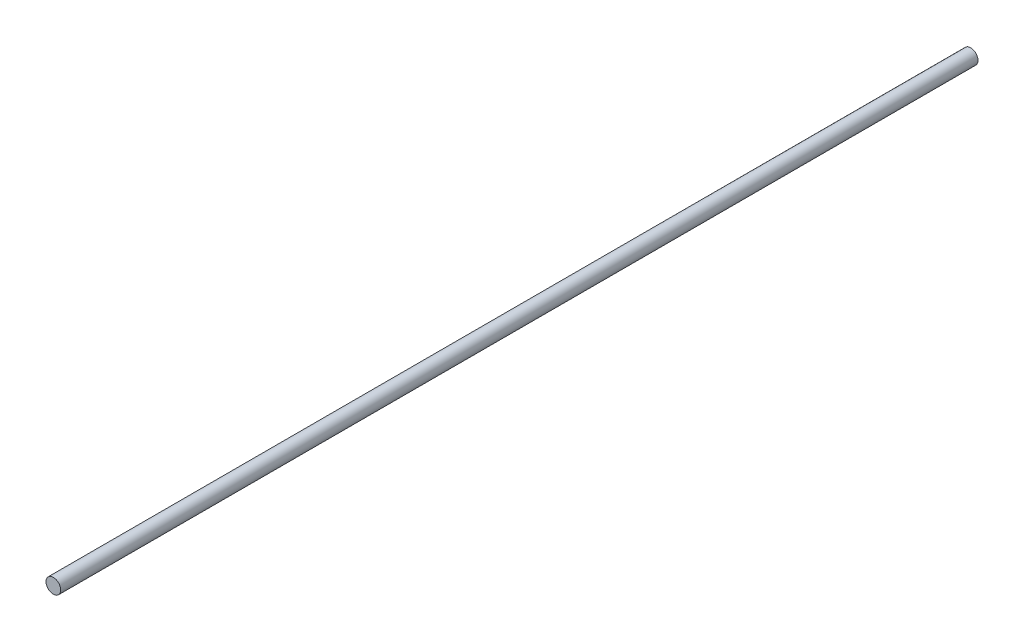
SolidWorks part; units mm, degrees
ref_plane "Front Plane" through (0, 0, 0) normal (0, 0, 1) x (1, 0, 0)
ref_plane "Top Plane" through (0, 0, 0) normal (0, 1, 0) x (1, 0, 0)
ref_plane "Right Plane" through (0, 0, 0) normal (1, 0, 0) x (0, 0, -1)
sketch "Sketch1" plane through (0, 0, 0) normal (0, 0, 1) x (1, 0, 0)
  circle A0 centre (0, 0) radius 8
  dimension "D1" = 16
extrude "Boss-Extrude1" add sketch "Sketch1" along normal blind 1000
